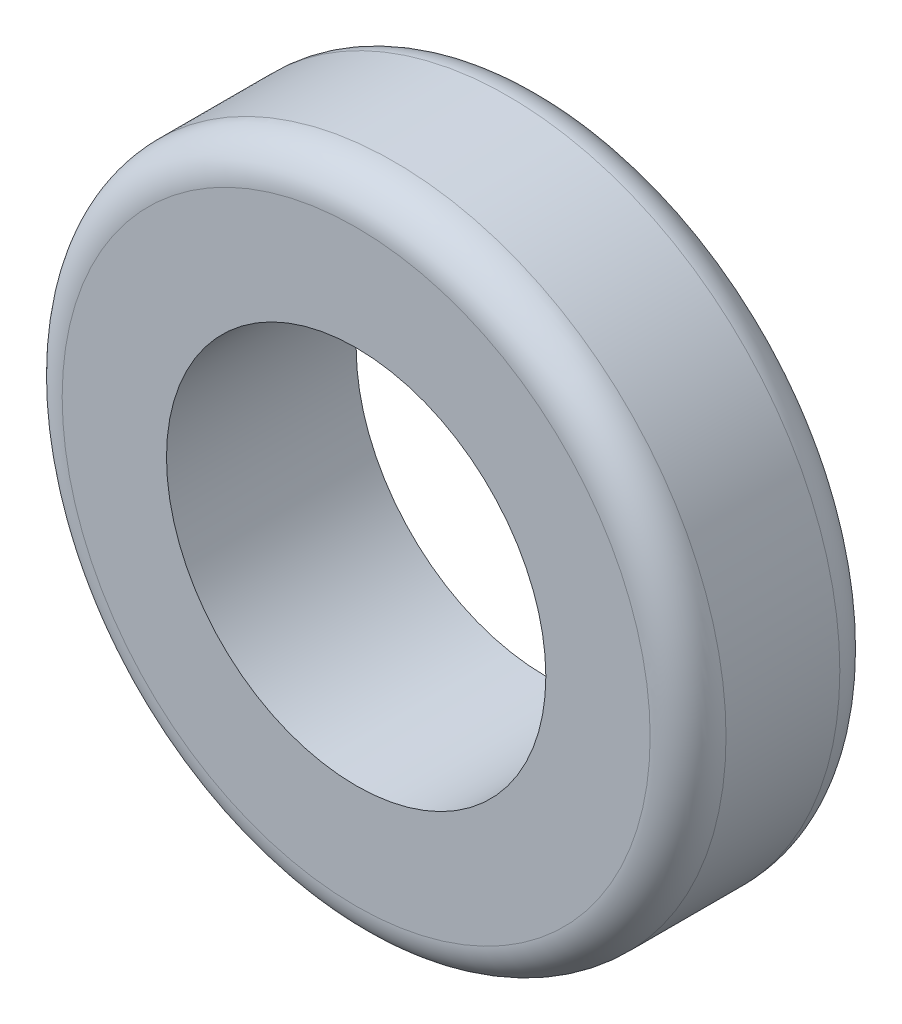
SolidWorks part; units mm, degrees
ref_plane "Plan1" through (0, 0, 0) normal (0, 0, 1) x (1, 0, 0)
ref_plane "Plan2" through (0, 0, 0) normal (0, 1, 0) x (1, 0, 0)
ref_plane "Plan3" through (0, 0, 0) normal (1, 0, 0) x (0, 0, -1)
sketch "Esquisse1" plane through (0, 0, 0) normal (0, 0, 1) x (1, 0, 0)
  circle A0 centre (0, 0) radius 1.75
  dimension "D1" = 3.5
extrude "Base-Extrusion" add sketch "Esquisse1" along normal blind 1
sketch "Esquisse2" plane through (0, 0, 1) normal (0, 0, 1) x (1, 0, 0)
  circle A0 centre (0, 0) radius 1
  dimension "D1" = 2
extrude "Enlèv. mat.-Extru.1" cut sketch "Esquisse2" against normal through all
fillet "Congé1" radius 0.2
